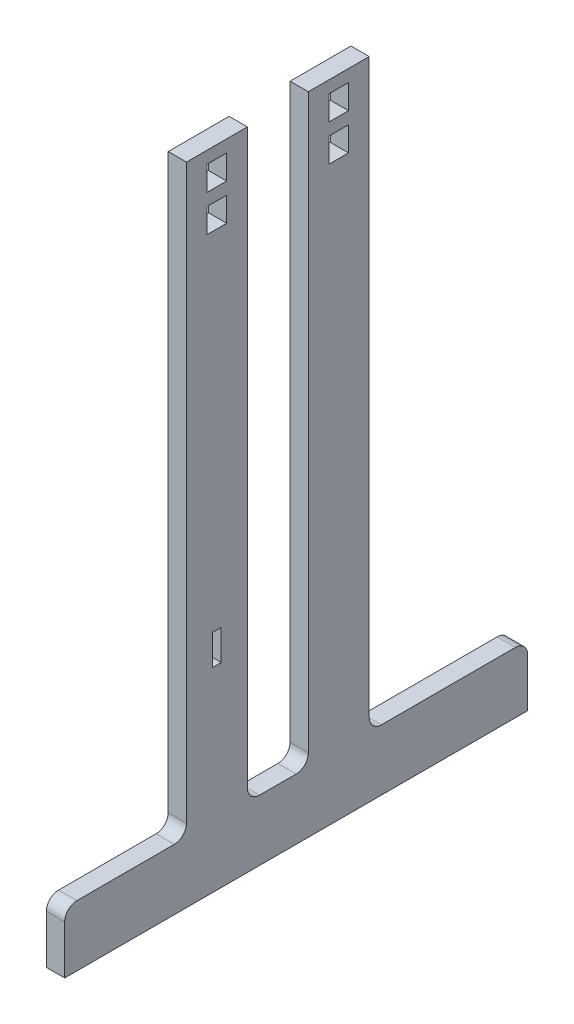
SolidWorks part; units mm, degrees
ref_plane "Alzado" through (0, 0, 0) normal (0, 0, 1) x (1, 0, 0)
ref_plane "Planta" through (0, 0, 0) normal (0, 1, 0) x (1, 0, 0)
ref_plane "Vista lateral" through (0, 0, 0) normal (1, 0, 0) x (0, 0, -1)
sketch "Croquis1" plane through (0, 0, 0) normal (1, 0, 0) x (0, 0, -1)
  line L0 (0, 0) -> (380, 0)
  line L1 (380, 0) -> (380, 50)
  line L2 (380, 50) -> (250, 50)
  line L3 (250, 50) -> (250, 530)
  line L4 (250, 530) -> (200, 530)
  line L5 (200, 530) -> (200, 50)
  line L6 (200, 50) -> (150, 50)
  line L7 (150, 50) -> (150, 530)
  line L8 (150, 530) -> (100, 530)
  line L9 (100, 530) -> (100, 50)
  line L10 (100, 50) -> (0, 50)
  line L11 (0, 50) -> (0, 0)
  line L12 (125, 530) -> (125, 0) construction
  line L13 (227.6561, 530) -> (227.6561, 0) construction
  circle A0 centre (125, 510) radius 7.5
  circle A1 centre (227.6561, 510) radius 7.5
  circle A2 centre (125, 480) radius 7.5
  circle A3 centre (227.6561, 480) radius 7.5
  dimension "D15" = 15
  dimension "D16" = 15
  dimension "D17" = 15
  dimension "D18" = 15
  dimension "D1" = 380
  dimension "D2" = 50
  dimension "D3" = 100
  dimension "D4" = 480
  dimension "D5" = 50
  dimension "D6" = 480
  dimension "D7" = 50
  dimension "D8" = 50
  dimension "D9" = 50
  dimension "D10" = 50
  dimension "D11" = 20
  dimension "D12" = 20
  dimension "D13" = 30
  dimension "D14" = 30
extrude "Saliente-Extruir1" add sketch "Croquis1" along normal blind 15 contours L11 L0 L1 L2 L3 L4 L5 L6 L7 L8 L9 L10
sketch "Croquis2" plane through (0, 0, 0) normal (1, 0, 0) x (0, 0, -1)
  line L0 (125, 530) -> (125, 0) construction
  line L1 (150, 530) -> (100, 530) construction
  line L2 (0, 0) -> (380, 0) construction
  line L3 (225, 530) -> (225, 324.7407) construction
  line L4 (250, 530) -> (200, 530) construction
fillet "Redondeo1" radius 10 4 edges at (7.5, 50, -250) (7.5, 50, -200) (7.5, 50, -150) (7.5, 50, -100)
fillet "Redondeo2" radius 10 1 edges at (7.5, 50, 0)
fillet "Redondeo3" radius 10 1 edges at (7.5, 50, -380)
sketch "Croquis3" plane through (0, 0, 0) normal (1, 0, 0) x (0, 0, -1)
  line L0 (225, 530) -> (225, 0) construction
  line L1 (0, 0) -> (380, 0) construction
  line L2 (125, 530) -> (125, 0) construction
  line L3 (150, 530) -> (100, 530) construction
  line L4 (117, 520) -> (133, 520)
  line L5 (117, 520) -> (117, 500)
  line L6 (117, 500) -> (133, 500)
  line L7 (133, 520) -> (133, 500)
  line L8 (117, 520) -> (133, 500) construction
  line L9 (117, 500) -> (133, 520) construction
  line L10 (217, 520) -> (233, 520)
  line L11 (217, 520) -> (217, 500)
  line L12 (217, 500) -> (233, 500)
  line L13 (233, 520) -> (233, 500)
  line L14 (217, 520) -> (233, 500) construction
  line L15 (217, 500) -> (233, 520) construction
  line L16 (117, 490) -> (133, 490)
  line L17 (117, 490) -> (117, 470)
  line L18 (117, 470) -> (133, 470)
  line L19 (133, 490) -> (133, 470)
  line L20 (117, 490) -> (133, 470) construction
  line L21 (117, 470) -> (133, 490) construction
  line L22 (217, 490) -> (233, 490)
  line L23 (217, 490) -> (217, 470)
  line L24 (217, 470) -> (233, 470)
  line L25 (233, 490) -> (233, 470)
  line L26 (217, 490) -> (233, 470) construction
  line L27 (217, 470) -> (233, 490) construction
  line L28 (250, 530) -> (200, 530) construction
  point P9 (125, 510)
  point P14 (225, 510)
  point P19 (125, 480)
  point P24 (225, 480)
  dimension "D1" = 20
  dimension "D2" = 20
  dimension "D3" = 16
  dimension "D4" = 16
  dimension "D5" = 30
  dimension "D6" = 16
  dimension "D7" = 30
  dimension "D8" = 16
  dimension "D9" = 20
  dimension "D10" = 20
  dimension "D11" = 20
  dimension "D12" = 20
extrude "Cortar-Extruir1" cut sketch "Croquis3" along normal through all
sketch "Croquis4" plane through (0, 0, 0) normal (1, 0, 0) x (0, 0, -1)
  line L0 (125, 0) -> (125, 231.6038) construction
  line L1 (125, 530) -> (125, 0) construction
  line L2 (190, 50) -> (160, 50) construction
  line L3 (121.5, 185) -> (128.5, 185)
  line L4 (121.5, 185) -> (121.5, 160)
  line L5 (121.5, 160) -> (128.5, 160)
  line L6 (128.5, 185) -> (128.5, 160)
  line L7 (121.5, 185) -> (128.5, 160) construction
  line L8 (121.5, 160) -> (128.5, 185) construction
  point P5 (125, 172.5)
  point P12 (125, 160)
  dimension "D1" = 110
  dimension "D2" = 25
  dimension "D3" = 7
extrude "Cortar-Extruir2" cut sketch "Croquis4" along normal through all
